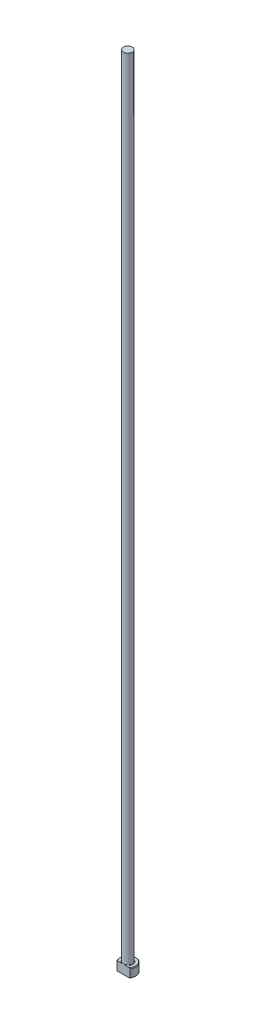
SolidWorks part; units mm, degrees
ref_plane "Front Plane" through (0, 0, 0) normal (0, 0, 1) x (1, 0, 0)
ref_plane "Top Plane" through (0, 0, 0) normal (0, 1, 0) x (1, 0, 0)
ref_plane "Right Plane" through (0, 0, 0) normal (1, 0, 0) x (0, 0, -1)
sketch "Sketch1" plane through (0, 0, 0) normal (0, 0, 1) x (1, 0, 0)
  line L0 (0, 259.9588) -> (0, -15.1925) construction
  line L1 (0, 0) -> (-3.5687, 0)
  line L2 (-3.5687, 0) -> (-3.5687, 3.9624)
  line L3 (-3.5687, 3.9624) -> (-1.9837, 3.9624)
  line L4 (-1.9837, 3.9624) -> (-1.9837, 355.6)
  line L5 (-1.9837, 355.6) -> (0, 355.6)
  line L6 (0, 355.6) -> (0, 0)
  dimension "L" = 355.6
  dimension "H" = 7.1374
  dimension "T" = 3.9624
  dimension "D" = 3.9675
revolve "Revolve1" add sketch "Sketch1" angle 360 about L0
chamfer "Chamfer1" distance 0.254 angle 45 2 edges at (0, 3.9624, 3.5687) (0, 0, 3.5687)
fillet "Fillet1" radius 0.254 1 edges at (0, 3.9624, 1.9837)
sketch "Sketch2" plane through (0, 0, 0) normal (0, 1, 0) x (1, 0, 0)
  line L0 (-2.9665, -1.9837) -> (2.9665, -1.9837)
  circle A0 centre (0, 0) radius 3.5687 construction
  arc A1 (-2.9665, -1.9837) -> (2.9665, -1.9837) centre (0, 0) ccw
  circle A3 centre (0, 0) radius 1.9837 construction
  dimension "D1" = 0
extrude "Key" cut sketch "Sketch2" along normal through all
sketch "Pocket Sketch" plane through (0, 0, 0) normal (0, 0, 1) x (1, 0, 0)
  line L0 (-3.9656, 0) -> (-3.9656, 3.9878)
  line L1 (-3.9656, 3.9878) -> (-2.9442, 3.9878)
  line L2 (-2.1822, 4.7498) -> (-2.1822, 22.225)
  line L3 (-2.1822, 22.225) -> (0, 22.225)
  line L4 (0, 22.225) -> (0, 0)
  line L5 (0, 0) -> (-3.9656, 0)
  line L6 (0, 12.6104) -> (0, -2.4989) construction
  line L7 (-3.5687, 3.7084) -> (-3.5687, 0.254) construction
  line L8 (3.3147, 3.9624) -> (-3.3147, 3.9624) construction
  line L9 (-1.9837, 355.6) -> (-1.9837, 4.2164) construction
  line L10 (-2.9442, 3.9878) -> (-2.1822, 4.7498)
  point P3 (-2.1822, 3.9878)
  dimension "D1" = 7.9311
  dimension "D2" = 0.3969
  dimension "D3" = 0.0254
  dimension "D4" = 0.1984
  dimension "D5" = 4.3644
  dimension "D6" = 22.225
